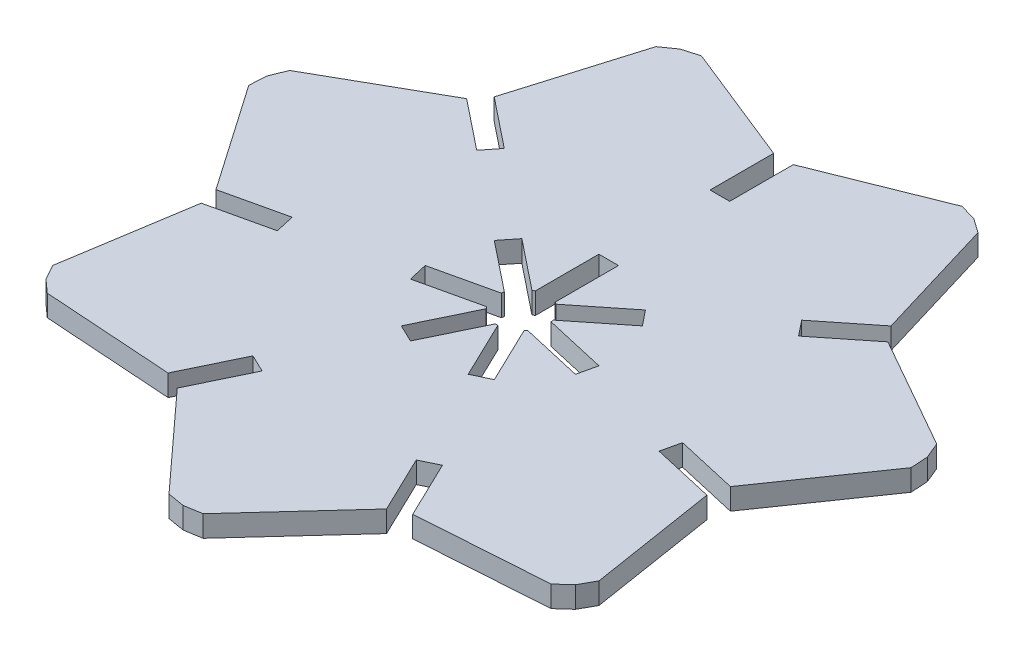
SolidWorks part; units mm, degrees
ref_plane "Alzado" through (0, 0, 0) normal (0, 0, 1) x (1, 0, 0)
ref_plane "Planta" through (0, 0, 0) normal (0, 1, 0) x (1, 0, 0)
ref_plane "Vista lateral" through (0, 0, 0) normal (1, 0, 0) x (0, 0, -1)
sketch "Croquis1" plane through (0, 0, 0) normal (0, 1, 0) x (1, 0, 0)
  line L0 (-16, 36.6197) -> (-1.15, 30.6634) construction
  line L1 (-1.15, 30.6634) -> (-1.15, 23.2114) construction
  line L2 (-1.15, 23.2114) -> (1.15, 23.2114) construction
  line L3 (1.15, 23.2114) -> (1.15, 30.6634) construction
  line L4 (1.15, 30.6634) -> (16, 36.6197) construction
  line L5 (16, 36.6197) -> (29.0824, 27.4083) construction
  line L6 (-16, 36.6197) -> (-29.0824, 27.4083) construction
  line L7 (0, 23.2114) -> (0, 0) construction
  line L8 (-16, 36.6197) -> (16, 36.6197) construction
  line L9 (-29.0824, 27.4083) -> (-29.0824, 103.2114) construction
  line L10 (-29.0824, 103.2114) -> (29.0824, 103.2114) construction
  line L11 (29.0824, 103.2114) -> (29.0824, 27.4083) construction
  circle A0 centre (0, 0) radius 39.9625
  circle A1 centre (0, 0) radius 2.9625
extrude "Saliente-Extruir1" add sketch "Croquis1" along normal mid plane 2.5 contours A0
sketch "Croquis2" plane through (0, 1.25, 0) normal (0, 1, 0) x (1, 0, 0)
  line L0 (-29.0824, 103.2114) -> (29.0824, 103.2114) construction
  line L1 (-1.15, 23.2114) -> (1.15, 23.2114) construction
  line L2 (-29.0824, 27.4083) -> (-29.0824, 103.2114) construction
  line L3 (-16, 36.6197) -> (-29.0824, 27.4083) construction
  line L4 (-16, 36.6197) -> (-1.15, 30.6634) construction
  line L5 (-1.15, 30.6634) -> (-1.15, 23.2114) construction
  line L6 (1.15, 23.2114) -> (1.15, 30.6634) construction
  line L7 (1.15, 30.6634) -> (16, 36.6197) construction
  line L8 (16, 36.6197) -> (29.0824, 27.4083) construction
  line L9 (29.0824, 103.2114) -> (29.0824, 27.4083) construction
  line L10 (-29.0824, 103.2114) -> (29.0824, 103.2114)
  line L11 (-1.15, 23.2114) -> (1.15, 23.2114)
  line L12 (-29.0824, 27.4083) -> (-29.0824, 103.2114)
  line L13 (-16, 36.6197) -> (-29.0824, 27.4083)
  line L14 (-16, 36.6197) -> (-1.15, 30.6634)
  line L15 (-1.15, 30.6634) -> (-1.15, 23.2114)
  line L16 (1.15, 23.2114) -> (1.15, 30.6634)
  line L17 (1.15, 30.6634) -> (16, 36.6197)
  line L18 (16, 36.6197) -> (29.0824, 27.4083)
  line L19 (29.0824, 103.2114) -> (29.0824, 27.4083)
  line L20 (-1.15, 2.7302) -> (-1.15, 10.1822)
  line L21 (-1.15, 10.1822) -> (1.15, 10.1822)
  line L22 (1.15, 10.1822) -> (1.15, 2.7302)
  circle A1 centre (0, 0) radius 2.9625 construction
  arc A2 (-1.15, 2.7302) -> (1.15, 2.7302) centre (0, 0) cw
extrude "Cortar-Extruir2" cut sketch "Croquis2" against normal through all and the other way through all
pattern_circular "MatrizC1" count 7 over 360 about axis through (0, 0, 0) along (0, 1, 0) of "Cortar-Extruir2"
equation "\"Diameter\"= 80"
equation "\"Kerf\"= 0.15"
equation "\"D3@Croquis1\"=\"Diameter\"*0.4"
equation "\"Thickness\"= 2.5"
equation "\"N_Sides\"= 7"
equation "\"D2@Croquis1\"=\"Diameter\" / 6+\"Kerf\"/2"
equation "\"D7@Croquis1\"=\"Diameter\""
equation "\"D1@Saliente-Extruir1\"=\"Thickness\""
equation "\"D1@MatrizC1\"=\"N_Sides\""
equation "\"D4@Croquis1\"=\"Thickness\" -\"Kerf\" -0.05"
equation "\"D_Hole\"= 6"
equation "\"D8@Croquis1\"=\"D_Hole\"-\"Kerf\"/2"
equation "\"D1@Croquis1\"=\"Diameter\"-\"Kerf\"/2"
equation "\"D5@Croquis1\"=\"D3@Croquis1\"/2"
